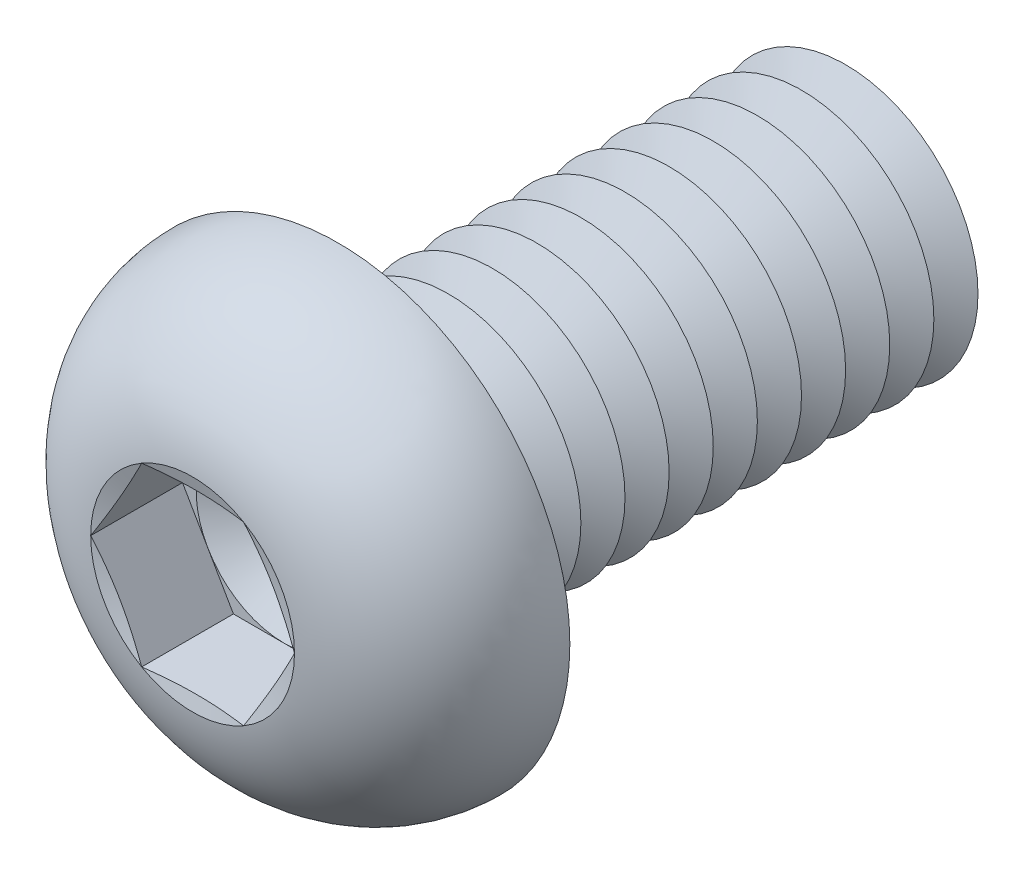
SolidWorks part; units mm, degrees
ref_plane "Front Plane" through (0, 0, 0) normal (0, 0, 1) x (1, 0, 0)
ref_plane "Top Plane" through (0, 0, 0) normal (0, 1, 0) x (1, 0, 0)
ref_plane "Right Plane" through (0, 0, 0) normal (1, 0, 0) x (0, 0, -1)
sketch "Sketch1" plane through (0, 0, 0) normal (1, 0, 0) x (0, 0, -1)
  line L0 (0, 3) -> (0, 5.25)
  line L3 (0, 3) -> (12, 3)
  line L4 (12, 3) -> (12, 0)
  line L5 (12, 0) -> (-3.3, 0) construction
  line L6 (-3.3, 0) -> (12, 0)
  line L7 (-3.3, 2.3094) -> (-3.3, 1.1547) construction
  line L8 (-3.3, 1.1547) -> (-3.3, 0)
  line L9 (-3.3, 2.3094) -> (-2.9906, 1.1547)
  line L10 (-2.9906, 1.1547) -> (-3.3, 1.1547)
  line L11 (12, 0) -> (22.7481, 0) construction
  line L12 (0, 5.25) -> (-3.3, 5.25) construction
  arc A1 (0, 5.25) -> (-3.3, 2.3094) centre (0, 1.928) ccw
  point P8 (12, 1.5)
  dimension "D1" = 10.5
  dimension "D2" = 6
  dimension "D3" = 3.3
  dimension "D4" = 4.6188
  dimension "D5" = 12
  dimension "D6" = 15
revolve "Revolve1" add sketch "Sketch1" angle 360 about L5
fillet "Fillet1" radius 0.5 1 edges at (-3, 0, 0)
sketch "Sketch2" plane through (0, 0, 0) normal (1, 0, 0) x (0, 0, -1)
  line L0 (11.5, 3) -> (12.5, 3)
  line L1 (12, 3) -> (0.5, 3) construction
  line L2 (12.5, 3) -> (12, 2.134)
  line L3 (12, -3) -> (12, 3) construction
  line L4 (12, 2.134) -> (11.5, 3)
  dimension "D1" = 1
revolve "Cut-Revolve1" cut sketch "Sketch2" angle 360 about axis through (0, 0, -12) along (0, 0, -1)
pattern_linear "LPattern1" count 12 spacing 1 along (0, 0, 1) of "Cut-Revolve1"
sketch "Sketch3" plane through (0, 0, 3.3) normal (0, 0, 1) x (1, 0, 0)
  line L7 (1.1547, 2) -> (-1.1547, 2)
  line L8 (-1.1547, 2) -> (-2.3094, 0)
  line L9 (-2.3094, 0) -> (-1.1547, -2)
  line L10 (-1.1547, -2) -> (1.1547, -2)
  line L11 (1.1547, -2) -> (2.3094, 0)
  line L12 (2.3094, 0) -> (1.1547, 2)
  circle A0 centre (0, 0) radius 2 construction
  circle A3 centre (0, 0) radius 2.3094 construction
extrude "Cut-Extrude1" cut sketch "Sketch3" against normal blind 2.08
sketch "Sketch4" plane through (0, 0, 1.22) normal (0, 0, 1) x (1, 0, 0)
  line L1 (1.1547, 2) -> (-1.1547, 2) construction
  circle A0 centre (0, 0) radius 2
extrude "Cut-Extrude2" cut sketch "Sketch4" against normal through all draft 60
